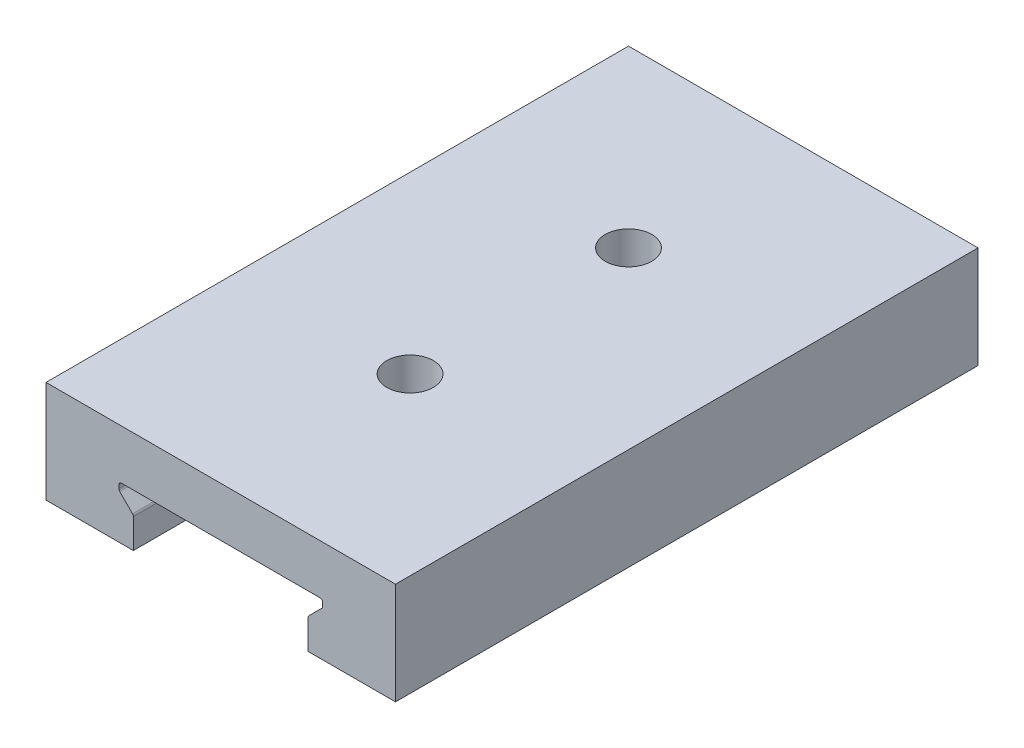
SolidWorks part; units mm, degrees
ref_plane "Front" through (0, 0, 0) normal (0, 0, 1) x (1, 0, 0)
ref_plane "bottom" through (0, 0, 0) normal (0, 1, 0) x (1, 0, 0)
ref_plane "Right" through (0, 0, 0) normal (1, 0, 0) x (0, 0, -1)
sketch "Sketch1" plane through (0, 0, 0) normal (0, 0, 1) x (1, 0, 0)
  line L1 (-6, 4.5) -> (6, 4.5)
  line L2 (-6, 4.5) -> (-6, 1)
  line L3 (-6, 1) -> (6, 1)
  line L4 (6, 4.5) -> (6, 1)
  point P4 (0, 1)
  dimension "D1" = 12
  dimension "D2" = 3.5
  dimension "D3" = 4.5
extrude "Extrude1" add sketch "Sketch1" along normal blind 20
sketch "Sketch2" plane through (0, 0, 0) normal (0, 0, -1) x (-1, 0, 0)
  line L0 (0, 2.8) -> (3.5, 2.8)
  line L2 (0, 2.8) -> (0, 0)
  line L3 (0, 0) -> (3, 0)
  line L4 (3, 2.05) -> (3, 0)
  line L5 (3.5, 2.8) -> (3.5, 2.55)
  line L6 (3.5, 2.55) -> (3, 2.05)
  dimension "D1" = 2.8
  dimension "D2" = 3
  dimension "D3" = 45
  dimension "D4" = 0.25
  dimension "D5" = 0.5
extrude "Cut-Extrude1" cut sketch "Sketch2" against normal through all
fillet "Fillet1" radius 0.1 3 edges at (-3, 2.05, 10) (-3.5, 2.55, 10) (-3.5, 2.8, 10)
mirror "Mirror1" about plane through (0, 0, 0) normal (1, 0, 0) of "Cut-Extrude1", "Fillet1"
hole_wizard "M2x0.4 Tapped Hole1" positions "Sketch4" profile "Sketch3" tap size "M2x0.4" standard "Ansi Metric"
sketch "Sketch4" plane through (0, 4.5, 0) normal (0, 1, 0) x (-1, 0, 0)
  line L0 (-6, 0) -> (6, 0) construction
  point P0 (0, 6)
  point P3 (0, 13.5)
  dimension "D1" = 6
  dimension "D2" = 7.5
sketch "Sketch3" plane through (0, 4.5, 6) normal (1, 0, 0) x (0, 0, 1)
  line L0 (0, 0) -> (0, 3.5)
  line L1 (0, 3.5) -> (0.8, 3.5)
  line L2 (0.8, 3.5) -> (0.8, 0)
  line L5 (0.8, 0) -> (0, 0)
  line L11 (0, -6.35) -> (0, 107.95) construction
  dimension "Thru Tap Drill Dia." = 1.6
  dimension "Thru Tap Drill Depth" = 3.5
ref_plane "center" through (0, 0, 10) normal (0, 0, 1) x (1, 0, 0)
sketch "Sketch5" plane through (0, 1, 0) normal (0, -1, 0) x (1, 0, 0)
  line L0 (-3.4, 0) -> (3.4, 0) construction
  line L1 (-4.6251, 18) -> (-15.353, 18)
  line L2 (-4.6251, 18) -> (-4.6251, 17.95)
  line L3 (-4.6251, 17.95) -> (-15.353, 17.95)
  line L4 (-15.353, 18) -> (-15.353, 17.95)
  dimension "D1" = 17.95
  dimension "D2" = 0.05
extrude "Cut-Extrude2" [suppressed] cut sketch "Sketch5" against normal blind 0.1
mirror "Mirror3" [suppressed] about plane through (0, 0, 10) normal (0, 0, 1)
